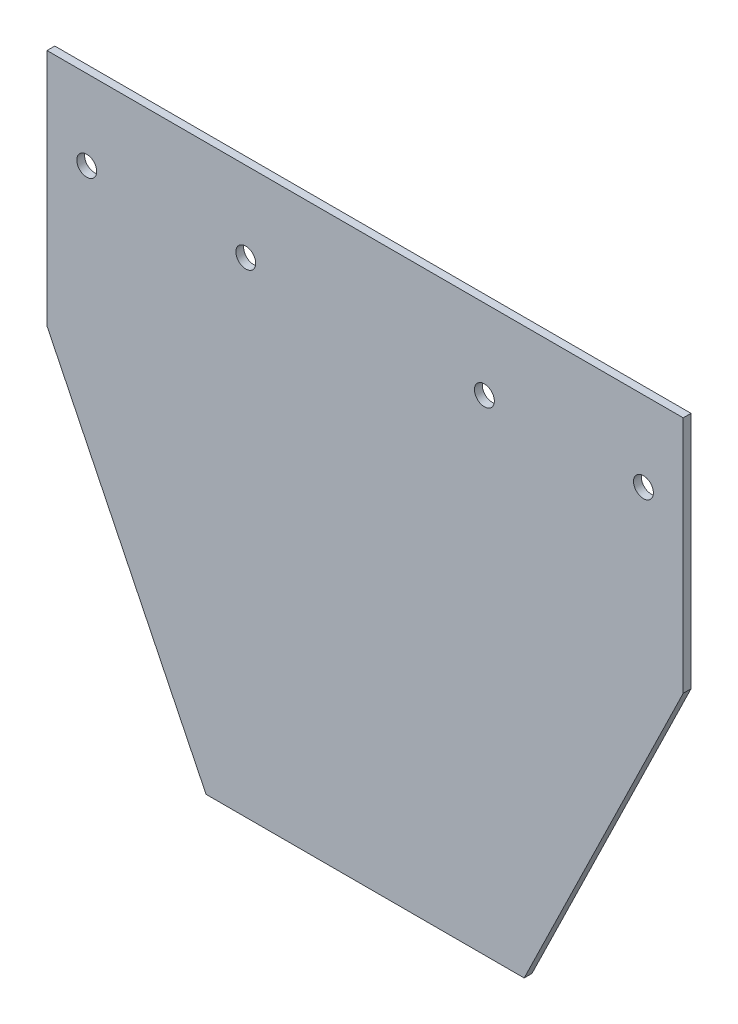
SolidWorks part; units mm, degrees
ref_plane "Front Plane" through (0, 0, 0) normal (0, 0, 1) x (1, 0, 0)
ref_plane "Top Plane" through (0, 0, 0) normal (0, 1, 0) x (1, 0, 0)
ref_plane "Right Plane" through (0, 0, 0) normal (1, 0, 0) x (0, 0, -1)
sketch "Sketch2" plane through (0, 0, 0) normal (0, 0, 1) x (1, 0, 0)
  line L0 (-50.8, -19.05) -> (-25.4, -71.12)
  line L1 (-50.8, 19.05) -> (50.8, 19.05)
  line L2 (-50.8, 19.05) -> (-50.8, -19.05)
  line L4 (50.8, 19.05) -> (50.8, -19.05)
  line L5 (-50.8, 19.05) -> (50.8, -19.05) construction
  line L6 (0, 0) -> (50.8, 19.05) construction
  line L7 (-25.4, -71.12) -> (25.4, -71.12)
  line L11 (-25.4, -71.12) -> (0, -39.37) construction
  line L12 (-25.4, -7.62) -> (25.4, -71.12) construction
  line L13 (25.4, -71.12) -> (50.8, -19.05)
  point P0 (0, 0)
  point P6 (0, -39.37)
  dimension "D1" = 101.6
  dimension "D2" = 38.1
  dimension "D3" = 52.07
  dimension "D4" = 50.8
extrude "Boss-Extrude1" add sketch "Sketch2" along normal blind 1.2446
sketch "Sketch3" plane through (0, 0, 1.2446) normal (0, 0, 1) x (1, 0, 0)
  line L0 (-50.8, 6.2875) -> (50.8, 6.2875) construction
  line L1 (-50.8, 19.05) -> (-50.8, -19.05) construction
  line L2 (50.8, -19.05) -> (50.8, 19.05) construction
  line L3 (50.8, 19.05) -> (-50.8, 19.05) construction
  circle A0 centre (-44.45, 6.2875) radius 1.5875
  circle A1 centre (-19.05, 6.2875) radius 1.5875
  circle A2 centre (19.05, 6.2875) radius 1.5875
  circle A3 centre (44.45, 6.2875) radius 1.5875
  dimension "D6" = 3.175
  dimension "D7" = 3.175
  dimension "D8" = 3.175
  dimension "D9" = 3.175
  dimension "D1" = 12.7625
  dimension "D2" = 6.35
  dimension "D3" = 25.4
  dimension "D4" = 6.35
  dimension "D5" = 25.4
extrude "Cut-Extrude1" cut sketch "Sketch3" against normal blind 16.2306
